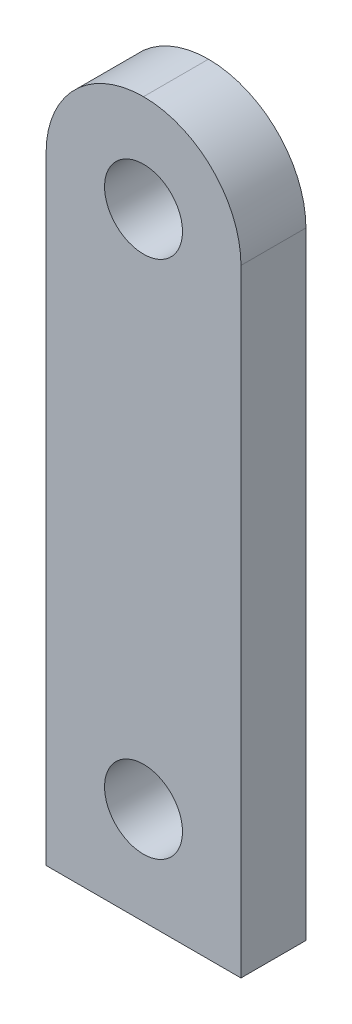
SolidWorks part; units mm, degrees
ref_plane "Plan de face" through (0, 0, 0) normal (0, 0, 1) x (1, 0, 0)
ref_plane "Plan de dessus" through (0, 0, 0) normal (0, 1, 0) x (1, 0, 0)
ref_plane "Plan de droite" through (0, 0, 0) normal (1, 0, 0) x (0, 0, -1)
sketch "Esquisse1" plane through (0, 0, 0) normal (0, 0, 1) x (1, 0, 0)
  line L0 (-30, 0) -> (-30, -110)
  line L1 (-30, -110) -> (0, -110)
  line L2 (0, -110) -> (0, 0)
  line L3 (0, 0) -> (-30, 0)
  line L4 (-15, -15) -> (-15, -95) construction
  circle A0 centre (-15, -15) radius 6
  circle A1 centre (-15, -95) radius 6
  dimension "D3" = 12
  dimension "D4" = 15
  dimension "D5" = 95
  dimension "D6" = 80
  dimension "D1" = 30
  dimension "D2" = 110
  dimension "D9" = 15
extrude "Extrusion1" add sketch "Esquisse1" along normal blind 10
fillet "Congé1" radius 15 2 edges at (-30, 0, 5) (0, 0, 5)
